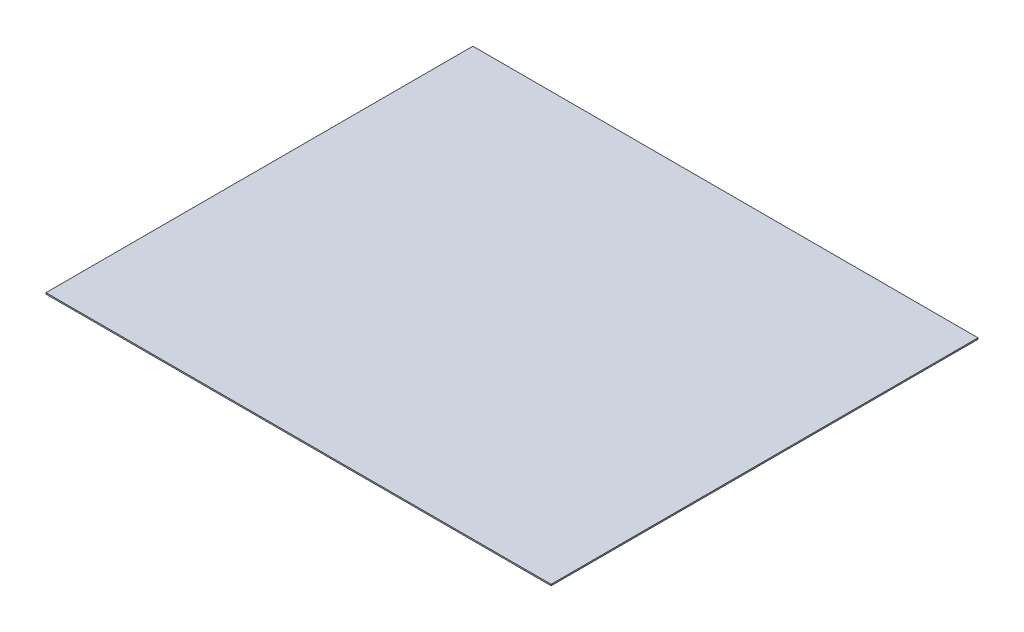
SolidWorks part; units mm, degrees
ref_plane "Front Plane" through (0, 0, 0) normal (0, 0, 1) x (1, 0, 0)
ref_plane "Top Plane" through (0, 0, 0) normal (0, 1, 0) x (1, 0, 0)
ref_plane "Right Plane" through (0, 0, 0) normal (1, 0, 0) x (0, 0, -1)
sketch "Sketch1" plane through (0, 0, 0) normal (0, 1, 0) x (1, 0, 0)
  line L1 (-901.7, 762) -> (901.7, 762)
  line L2 (-901.7, 762) -> (-901.7, -762)
  line L3 (-901.7, -762) -> (901.7, -762)
  line L4 (901.7, 762) -> (901.7, -762)
  line L5 (-901.7, 762) -> (901.7, -762) construction
  line L6 (-901.7, -762) -> (901.7, 762) construction
  point P0 (0, 0)
  dimension "D1" = 1803.4
  dimension "D2" = 1524
extrude "Boss-Extrude1" add sketch "Sketch1" along normal blind 4.7625
